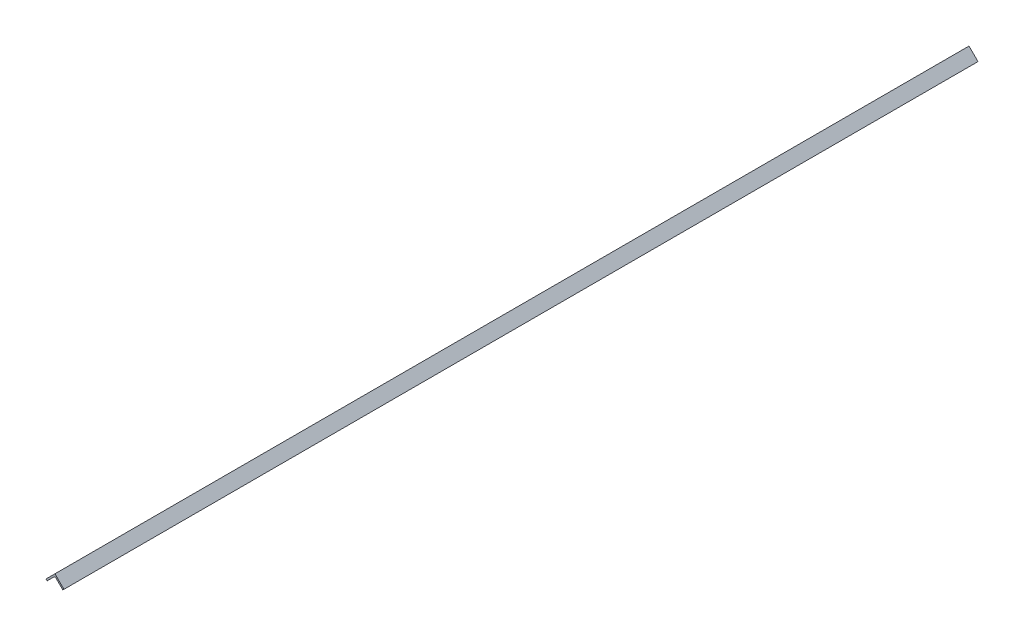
SolidWorks part; units mm, degrees
ref_plane "Front Plane" through (0, 0, 0) normal (0, 0, 1) x (1, 0, 0)
ref_plane "Top Plane" through (0, 0, 0) normal (0, 1, 0) x (1, 0, 0)
ref_plane "Right Plane" through (0, 0, 0) normal (1, 0, 0) x (0, 0, -1)
sketch "Sketch1" plane through (0, 0, 0) normal (0, 0, 1) x (1, 0, 0)
  line L0 (0, 0) -> (17.9605, -17.9605)
  line L1 (0, 0) -> (-17.9605, -17.9605)
  line L2 (-17.9605, -17.9605) -> (-15.7154, -20.2056)
  line L3 (-15.7154, -20.2056) -> (-1.7961, -6.2862)
  line L4 (1.7961, -6.2862) -> (15.7154, -20.2056)
  line L5 (15.7154, -20.2056) -> (17.9605, -17.9605)
  line L6 (0, 0) -> (21.9472, 0) construction
  arc A0 (-1.7961, -6.2862) -> (1.7961, -6.2862) centre (0, -8.0822) cw
  dimension "D5" = 2.54
  dimension "D1" = 25.4
  dimension "D2" = 45
  dimension "D3" = 3.175
  dimension "D4" = 3.175
extrude "Boss-Extrude1" add sketch "Sketch1" against normal blind 1828.8
